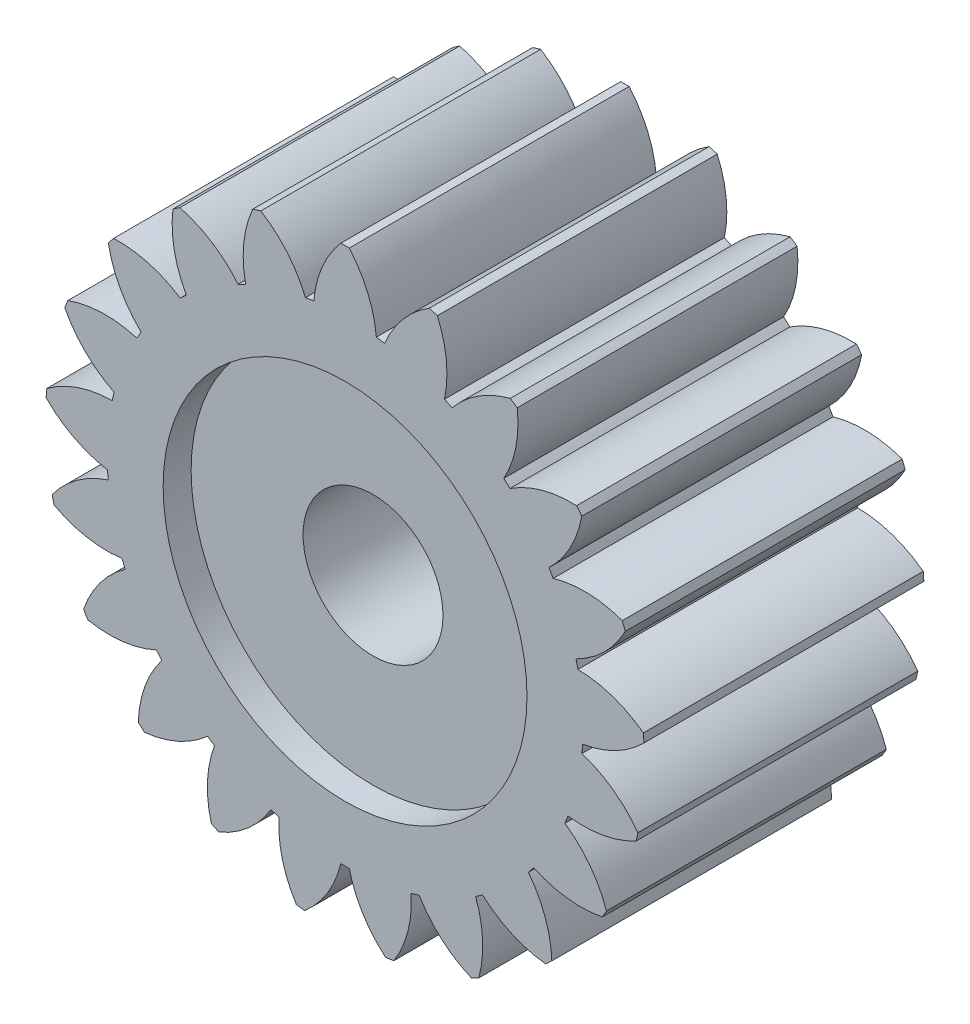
SolidWorks part; units mm, degrees
ref_plane "Plan1" through (0, 0, 0) normal (0, 0, 1) x (1, 0, 0)
ref_plane "Plan2" through (0, 0, 0) normal (0, 1, 0) x (1, 0, 0)
ref_plane "Plan3" through (0, 0, 0) normal (1, 0, 0) x (0, 0, -1)
sketch "Esquisse1" plane through (0, 0, 0) normal (0, 0, 1) x (1, 0, 0)
  circle A0 centre (0, 0) radius 10.7
  dimension "D1" = 21.4
extrude "Base-Extrusion" add sketch "Esquisse1" along normal blind 10
sketch "Esquisse4" plane through (0, 0, 10) normal (0, 0, 1) x (1, 0, 0)
  line L0 (0, 0) -> (0, 13.9994) construction
  line L1 (0, 0) -> (2.1339, 14.1573) construction
  line L2 (0, 0) -> (4.3518, 14.1083) construction
  line L3 (1.2669, 8.4051) -> (2.0586, 13.6576)
  line L4 (-1.2669, 8.4051) -> (-2.0586, 13.6576)
  line L5 (2.0586, 13.6576) -> (-2.0586, 13.6576)
  circle A0 centre (0, 0) radius 10.7 construction
  circle A1 centre (0, 0) radius 8.5 construction
  arc A2 (-1.1183, 8.4261) -> (-1.2669, 8.4051) centre (0, 0) ccw
  arc A3 (-0.15, 10.6989) -> (0.15, 10.6989) centre (0, 0) cw
  arc A4 (0.15, 10.6989) -> (1.1183, 8.4261) centre (-2.8659, 8.0713) cw
  arc A7 (-0.15, 10.6989) -> (-1.1183, 8.4261) centre (2.8659, 8.0713) ccw
  arc A8 (1.1183, 8.4261) -> (1.2669, 8.4051) centre (0, 0) cw
  dimension "D1" = 17
  dimension "D2" = 21.4
  dimension "D7" = 4
  dimension "D3" = 8.571
  dimension "D4" = 17.143
  dimension "D5" = 0.15
  dimension "D6" = 0.15
extrude "Enlèv. mat.-Extru.2" cut sketch "Esquisse4" against normal through all
pattern_circular "Répétition circulaire2" count 21 over 360 about axis through (0, 0, 0) along (0, 0, 1) of "Enlèv. mat.-Extru.2"
sketch "Esquisse5" plane through (0, 0, 10) normal (0, 0, 1) x (1, 0, 0)
  circle A0 centre (0, 0) radius 6.5
  dimension "D1" = 13
extrude "Enlèv. mat.-Extru.3" cut sketch "Esquisse5" against normal blind 1
sketch "Esquisse6" plane through (0, 0, 0) normal (0, 0, -1) x (-1, 0, 0)
  line L0 (-10.0339, 0) -> (12.0946, 0) construction
  line L1 (0, 9.8941) -> (0, -9.8941) construction
  line L2 (2.3848, 0.75) -> (5, 0.75)
  line L3 (-5, 0.75) -> (-2.3848, 0.75)
  line L4 (-5, 0.75) -> (-5, -0.75)
  line L5 (-5, -0.75) -> (-2.3848, -0.75)
  line L6 (5, 0.75) -> (5, -0.75)
  line L7 (2.3848, -0.75) -> (5, -0.75)
  arc A0 (2.3848, 0.75) -> (-2.3848, 0.75) centre (0, 0) ccw
  arc A1 (-2.3848, -0.75) -> (2.3848, -0.75) centre (0, 0) ccw
  dimension "D5" = 5
  dimension "D1" = 1.5
  dimension "D2" = 0.75
  dimension "D3" = 10
  dimension "D4" = 5
extrude "Enlèv. mat.-Extru.4" cut sketch "Esquisse6" against normal blind 1.5
sketch "Esquisse7" plane through (0, 0, 1.5) normal (0, 0, -1) x (-1, 0, 0)
  circle A0 centre (0, 0) radius 2.5
  dimension "D1" = 5
extrude "Enlèv. mat.-Extru.5" cut sketch "Esquisse7" against normal through all
